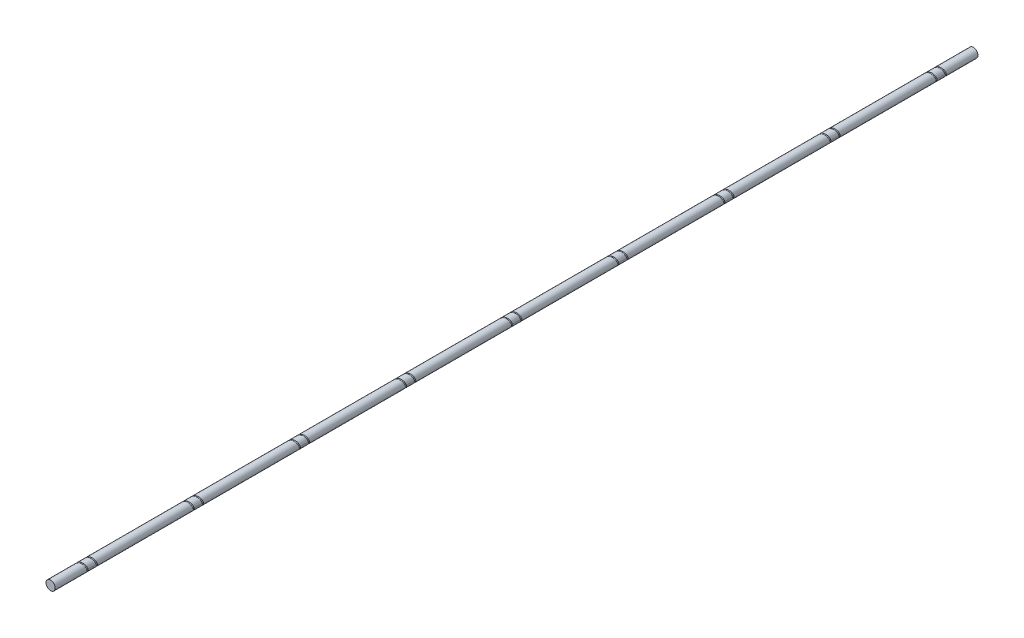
SolidWorks part; units mm, degrees
ref_plane "Front Plane" through (0, 0, 0) normal (0, 0, 1) x (1, 0, 0)
ref_plane "Top Plane" through (0, 0, 0) normal (0, 1, 0) x (1, 0, 0)
ref_plane "Right Plane" through (0, 0, 0) normal (1, 0, 0) x (0, 0, -1)
sketch "Sketch1" plane through (0, 0, 0) normal (0, 0, 1) x (1, 0, 0)
  circle A0 centre (0, 0) radius 25
  dimension "D1" = 50
extrude "Boss-Extrude1" add sketch "Sketch1" along normal blind 5000
ref_plane "Plane1" through (0, 0, 150) normal (0, 0, 1) x (1, 0, 0)
sketch "Sketch2" plane through (0, 0, 150) normal (0, 0, 1) x (1, 0, 0)
  circle A0 centre (0, 0) radius 27.646
  dimension "D1" = 55.292
curve "Helix/Spiral1"
sketch "Sketch3" plane through (0, 0, 0) normal (0, 1, 0) x (1, 0, 0)
  circle A0 centre (-27.646, -150) radius 3.969
  spline S0 degree 3 poles (-27.646, -150) (-27.646, -150.7073) (-26.9833, -152.1286) (-24.0718, -154.2551) (-19.4496, -156.383) (-13.4454, -158.5106) (-6.4857, -160.6383) (0.9349, -162.766) (8.289, -164.8936) (15.0541, -167.0213) (20.7495, -169.1489) (24.9703, -171.2766) (27.4167, -173.4043) (27.9149, -175.5319) (26.4293, -177.6596) (23.0657, -179.7872) (18.063, -181.9149) (11.7766, -184.0426) (4.6535, -186.1702) (-2.8004, -188.2979) (-10.0553, -190.4255) (-16.5956, -192.5532) (-21.9566, -194.6809) (-25.7573, -196.8085) (-27.7277, -198.9362) (-27.7277, -201.0638) (-25.7573, -203.1915) (-21.9566, -205.3191) (-16.5956, -207.4468) (-10.0553, -209.5745) (-2.8004, -211.7021) (4.6535, -213.8298) (11.7766, -215.9574) (18.063, -218.0851) (23.0657, -220.2128) (26.4293, -222.3404) (27.9149, -224.4681) (27.4167, -226.5957) (24.9703, -228.7234) (20.7495, -230.8511) (15.0541, -232.9787) (8.289, -235.1064) (0.9349, -237.234) (-6.4857, -239.3617) (-13.4454, -241.4894) (-19.4496, -243.617) (-24.0718, -245.7449) (-26.9833, -247.8714) (-27.646, -249.2927) (-27.646, -250) knots 0 0 0 0 0.021277 0.042553 0.06383 0.085106 0.106383 0.12766 0.148936 0.170213 0.191489 0.212766 0.234043 0.255319 0.276596 0.297872 0.319149 0.340426 0.361702 0.382979 0.404255 0.425532 0.446809 0.468085 0.489362 0.510638 0.531915 0.553191 0.574468 0.595745 0.617021 0.638298 0.659574 0.680851 0.702128 0.723404 0.744681 0.765957 0.787234 0.808511 0.829787 0.851064 0.87234 0.893617 0.914894 0.93617 0.957447 0.978723 1 1 1 1 construction
  dimension "D1" = 7.938
sweep "Cut-Sweep1" cut profiles "Sketch3" path "Helix/Spiral1"
pattern_linear "LPattern1" count 9 spacing 575 along (0, 0, -1) of "Cut-Sweep1"
